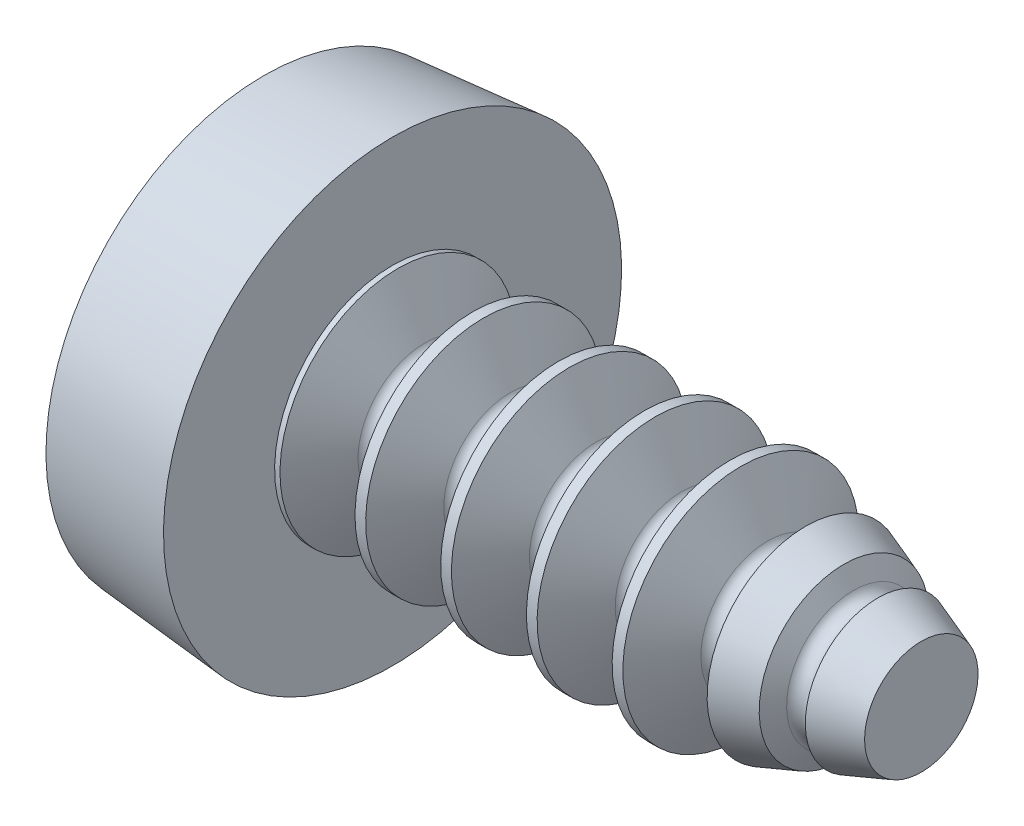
SolidWorks part; units mm, degrees
ref_plane "Front Plane" through (0, 0, 0) normal (0, 0, 1) x (1, 0, 0)
ref_plane "Top Plane" through (0, 0, 0) normal (0, 1, 0) x (1, 0, 0)
ref_plane "Right Plane" through (0, 0, 0) normal (1, 0, 0) x (0, 0, -1)
imported_body "Imported1"
sketch "Sketch1" plane through (0, 0, 0) normal (0, 0, 1) x (1, 0, 0)
  line L0 (0, -2.1209) -> (0, 2.1209) construction
  line L1 (4.8963, 1.3331) -> (6.6569, 1.3331)
  line L2 (4.8963, 1.3331) -> (4.8963, -1.4737)
  line L3 (4.8963, -1.4737) -> (6.6569, -1.4737)
  line L4 (6.6569, 1.3331) -> (6.6569, -1.4737)
  dimension "D1" = 4.8963
  dimension "D2" = 1.3331
  dimension "D3" = 2.8068
  dimension "D4" = 1.7606
extrude "Cut-Extrude1" cut sketch "Sketch1" against normal through all and the other way through all
